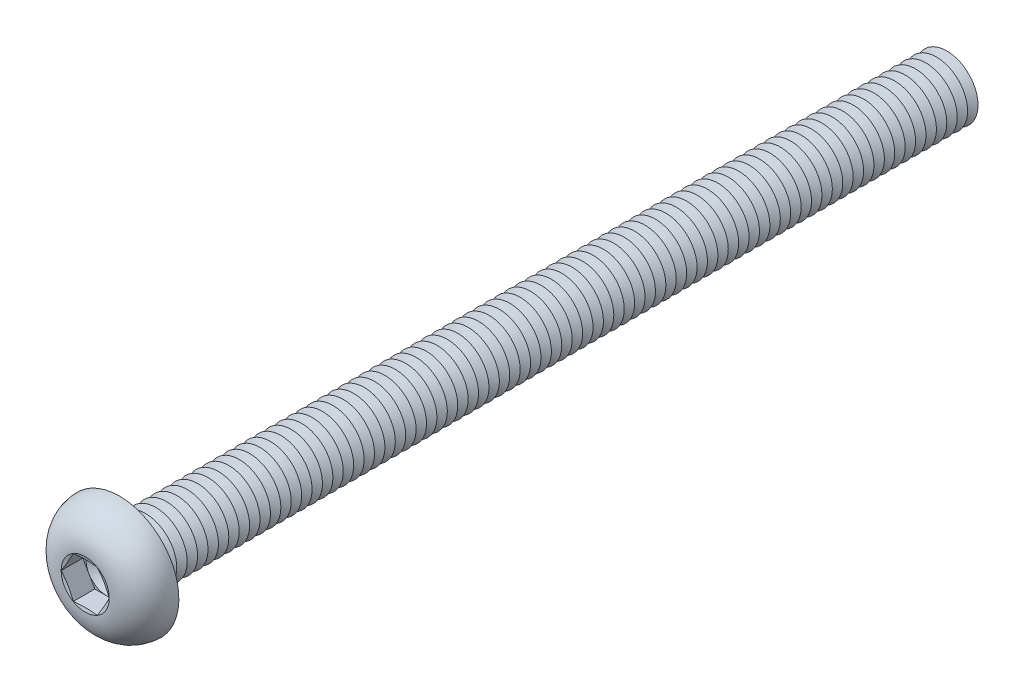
SolidWorks part; units mm, degrees
ref_plane "Front Plane" through (0, 0, 0) normal (0, 0, 1) x (1, 0, 0)
ref_plane "Top Plane" through (0, 0, 0) normal (0, 1, 0) x (1, 0, 0)
ref_plane "Right Plane" through (0, 0, 0) normal (1, 0, 0) x (0, 0, -1)
sketch "Sketch1" plane through (0, 0, 0) normal (1, 0, 0) x (0, 0, -1)
  line L0 (0, 1.5) -> (0, 2.85)
  line L3 (0, 1.5) -> (40, 1.5)
  line L4 (40, 1.5) -> (40, 0)
  line L5 (40, 0) -> (-1.65, 0) construction
  line L6 (-1.65, 0) -> (40, 0)
  line L7 (-1.65, 1.1547) -> (-1.65, 0.5773) construction
  line L8 (-1.65, 0.5773) -> (-1.65, 0)
  line L9 (-1.65, 1.1547) -> (-1.4953, 0.5773)
  line L10 (-1.4953, 0.5773) -> (-1.65, 0.5773)
  line L11 (40, 0) -> (22.7481, 0) construction
  line L12 (0, 2.85) -> (-1.65, 2.85) construction
  arc A1 (0, 2.85) -> (-1.65, 1.1547) centre (0, 1.1994) ccw
  point P8 (40, 0.75)
  dimension "D1" = 5.7
  dimension "D2" = 3
  dimension "D3" = 1.65
  dimension "D4" = 2.3094
  dimension "D5" = 40
  dimension "D6" = 15
revolve "Revolve1" add sketch "Sketch1" angle 360 about L5
fillet "Fillet1" radius 0.25 1 edges at (0, 1.5, 0)
sketch "Sketch2" plane through (0, 0, 0) normal (1, 0, 0) x (0, 0, -1)
  line L0 (39.75, 1.5) -> (40.25, 1.5)
  line L1 (40, 1.5) -> (0.25, 1.5) construction
  line L2 (40.25, 1.5) -> (40, 1.067)
  line L3 (40, -1.5) -> (40, 1.5) construction
  line L4 (40, 1.067) -> (39.75, 1.5)
  dimension "D1" = 0.5
revolve "Cut-Revolve1" cut sketch "Sketch2" angle 360 about axis through (0, 0, -40) along (0, 0, -1)
pattern_linear "LPattern1" count 80 spacing 0.5 along (0, 0, 1) of "Cut-Revolve1"
sketch "Sketch3" plane through (0, 0, 1.65) normal (0, 0, 1) x (1, 0, 0)
  line L7 (0.5773, 1) -> (-0.5774, 1)
  line L8 (-0.5774, 1) -> (-1.1547, 0)
  line L9 (-1.1547, 0) -> (-0.5773, -1)
  line L10 (-0.5773, -1) -> (0.5773, -1)
  line L11 (0.5773, -1) -> (1.1547, 0)
  line L12 (1.1547, 0) -> (0.5773, 1)
  circle A0 centre (0, 0) radius 1 construction
  circle A3 centre (0, 0) radius 1.1547 construction
extrude "Cut-Extrude1" cut sketch "Sketch3" against normal blind 1.04
sketch "Sketch4" plane through (0, 0, 0.61) normal (0, 0, 1) x (1, 0, 0)
  line L1 (0.5773, 1) -> (-0.5774, 1) construction
  circle A0 centre (0, 0) radius 1
extrude "Cut-Extrude2" cut sketch "Sketch4" against normal through all draft 60
